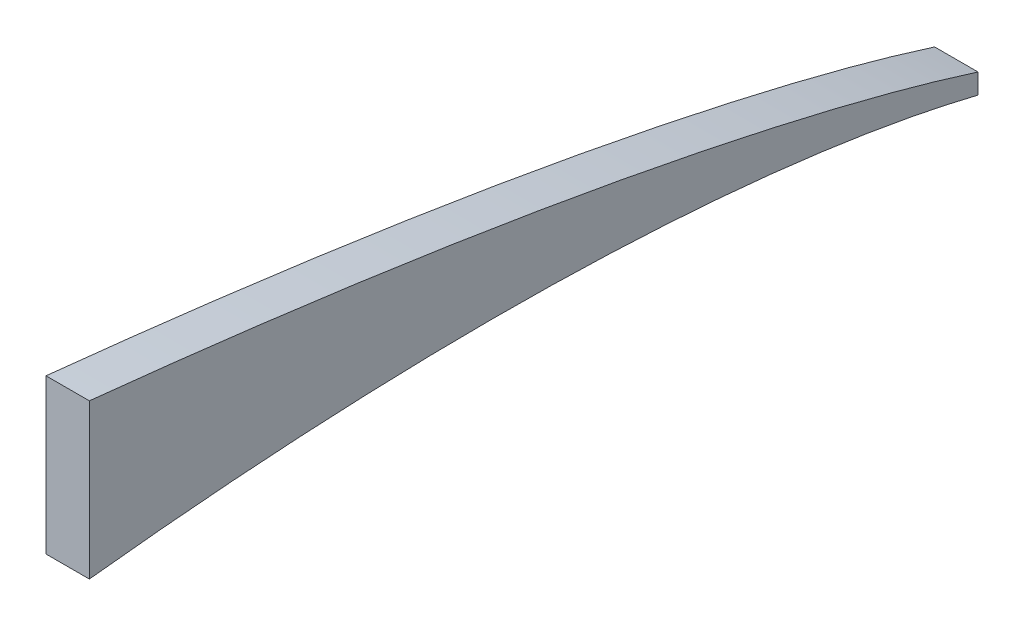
SolidWorks part; units mm, degrees
ref_plane "Front Plane" through (0, 0, 0) normal (0, 0, 1) x (1, 0, 0)
ref_plane "Top Plane" through (0, 0, 0) normal (0, 1, 0) x (1, 0, 0)
ref_plane "Right Plane" through (0, 0, 0) normal (1, 0, 0) x (0, 0, -1)
curve "Curve1"
sketch "Sketch1" plane through (0, 0, 0) normal (1, 0, 0) x (0, 0, -1)
  line L1 (0, 0) -> (0, 95.7684) construction
  line L2 (68.2625, 18.3471) -> (68.2625, 7.0409)
  line L3 (133.35, 6.6637) -> (133.35, 5.1955)
  spline S0 degree 3 poles (68.2625, 7.0409) (69.782, 7.2104) (73.625, 7.6114) (79.8029, 8.1339) (86.7744, 8.5503) (93.6864, 8.7782) (100.4641, 8.8049) (107.0318, 8.6286) (113.3143, 8.2533) (119.236, 7.6839) (124.7265, 6.9422) (129.3863, 6.1083) (132.1999, 5.4788) (133.35, 5.1955) knots 0.741103 0.741103 0.741103 0.741103 0.756094 0.778989 0.80189 0.824567 0.846792 0.868338 0.888978 0.908492 0.926659 0.943286 0.954903 0.954903 0.954903 0.954903
  spline S2 degree 3 poles (133.35, 6.6637) (133.0284, 6.7668) (131.6243, 7.2091) (129.0223, 7.9736) (125.4363, 8.9375) (121.5437, 9.8985) (117.367, 10.8497) (112.9309, 11.7852) (108.2627, 12.7002) (103.3896, 13.5833) (98.3422, 14.4334) (93.1497, 15.2395) (87.8456, 16.0032) (82.4639, 16.7184) (77.0437, 17.3828) (72.3057, 17.9237) (69.3783, 18.2332) (68.2625, 18.3471) knots 1.047399 1.047399 1.047399 1.047399 1.05071 1.061833 1.073989 1.087118 1.101145 1.115991 1.13157 1.147788 1.164551 1.181758 1.199312 1.217095 1.23499 1.252857 1.263854 1.263854 1.263854 1.263854
  dimension "D2" = 68.2625
  dimension "D3" = 133.35
extrude "Boss-Extrude1" add sketch "Sketch1" along normal blind 3.175
